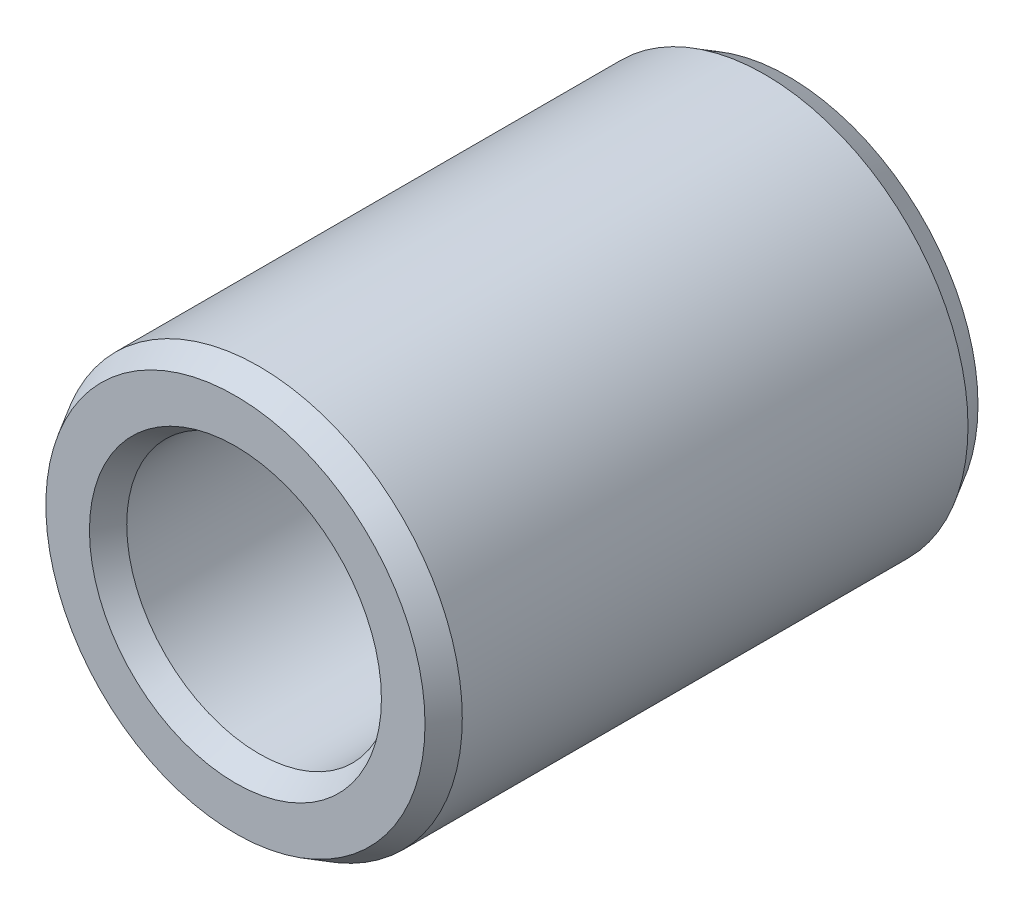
SolidWorks part; units mm, degrees
ref_plane "Plane1" through (0, 0, 0) normal (0, 0, 1) x (1, 0, 0)
ref_plane "Plane2" through (0, 0, 0) normal (0, 1, 0) x (1, 0, 0)
ref_plane "Plane3" through (0, 0, 0) normal (1, 0, 0) x (0, 0, -1)
sketch "Sketch1" plane through (0, 0, 0) normal (0, 0, 1) x (1, 0, 0)
  circle A0 centre (0, 0) radius 2.1844
  circle A1 centre (0, 0) radius 1.4224
  dimension "D1" = 2.8448
  dimension "D2" = 4.3688
extrude "Base-Extrude" add sketch "Sketch1" along normal blind 5.9436
chamfer "Chamfer2" distance 0.254 angle 30 4 edges at (2.1844, 0, 0) (2.1844, 0, 5.9436) (1.4224, 0, 0) (1.4224, 0, 5.9436)
